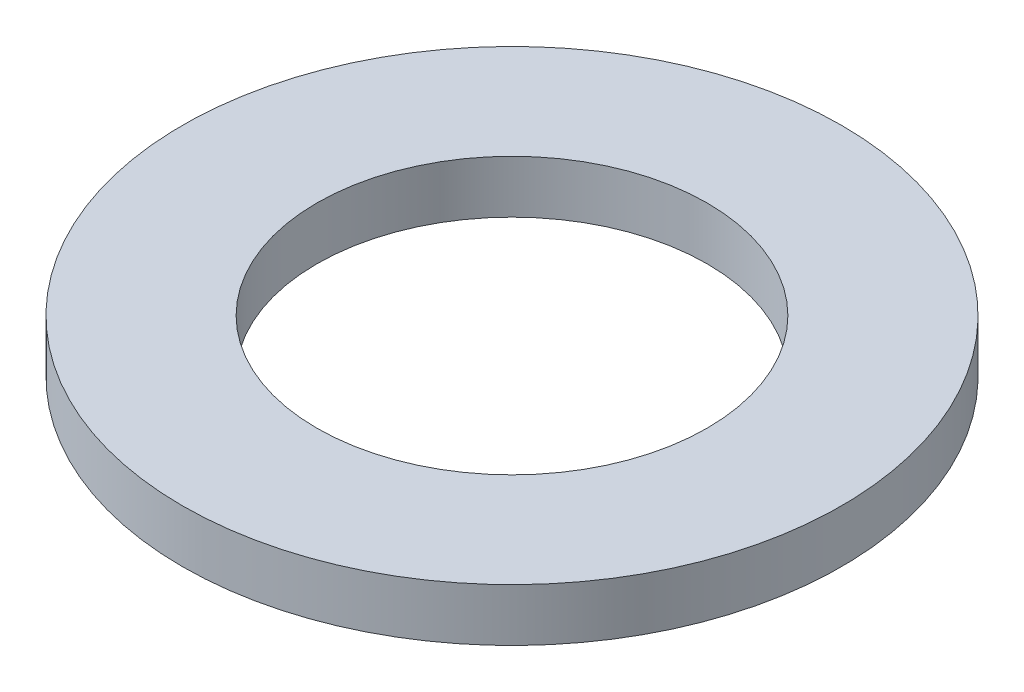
SolidWorks part; units mm, degrees
ref_plane "Front" through (0, 0, 0) normal (0, 0, 1) x (1, 0, 0)
ref_plane "Top" through (0, 0, 0) normal (0, 1, 0) x (1, 0, 0)
ref_plane "Right" through (0, 0, 0) normal (1, 0, 0) x (0, 0, -1)
sketch "Sketch1" plane through (0, 0, 0) normal (0, 1, 0) x (1, 0, 0)
  circle A0 centre (0, 0) radius 37
  circle A1 centre (0, 0) radius 62.5
extrude "Extrude1" add sketch "Sketch1" along normal blind 10
